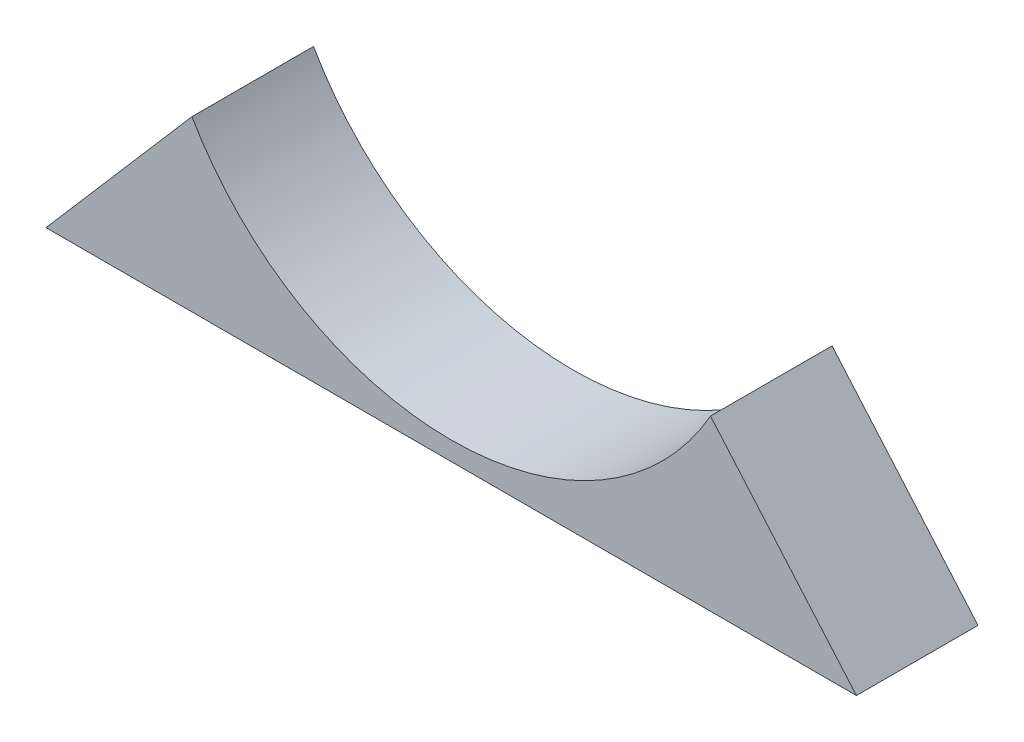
SolidWorks part; units mm, degrees
ref_plane "Front Plane" through (0, 0, 0) normal (0, 0, 1) x (1, 0, 0)
ref_plane "Top Plane" through (0, 0, 0) normal (0, 1, 0) x (1, 0, 0)
ref_plane "Right Plane" through (0, 0, 0) normal (1, 0, 0) x (0, 0, -1)
sketch "Sketch1" plane through (0, 0, 0) normal (0, 0, 1) x (1, 0, 0)
  line L0 (-93.1295, -72.936) -> (93.1295, -72.936)
  line L1 (93.1295, -72.936) -> (59.5898, -34.0713)
  line L2 (-59.5898, -34.0713) -> (-93.1295, -72.936)
  line L3 (0, 0) -> (0, -115.3656) construction
  arc A1 (-59.5898, -34.0713) -> (59.5898, -34.0713) centre (0, 0) ccw
extrude "Extrude1" add sketch "Sketch1" along normal blind 27.94
